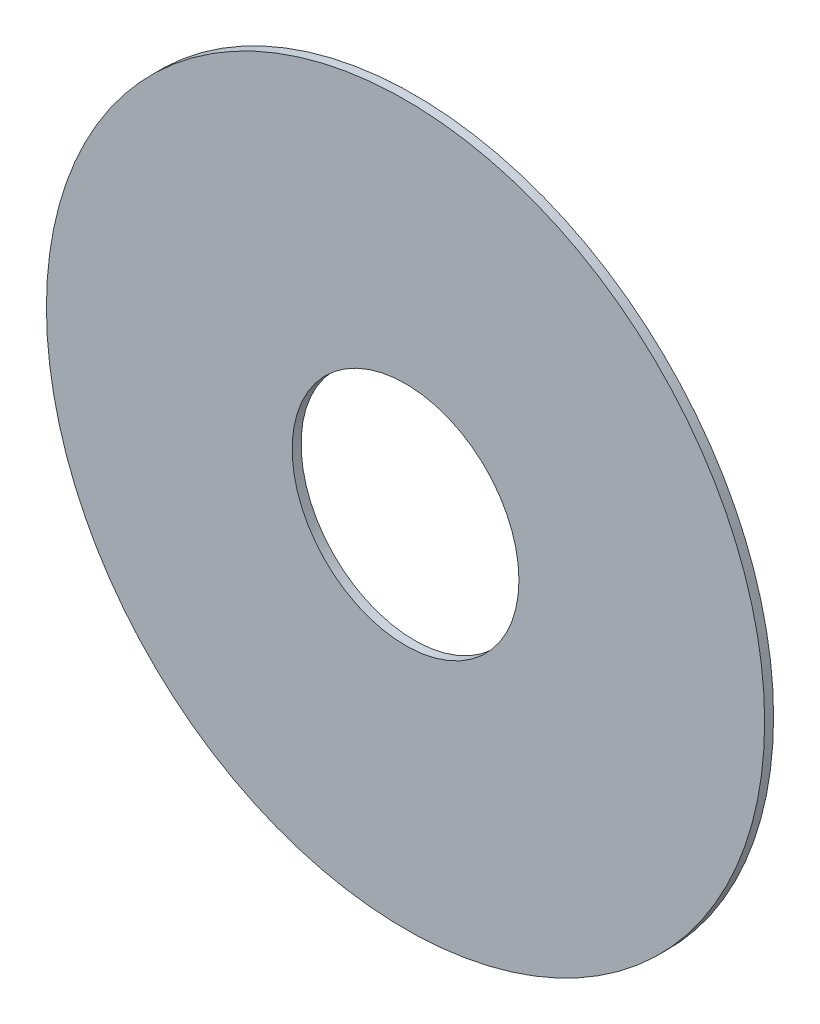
SolidWorks part; units mm, degrees
ref_plane "Front Plane" through (0, 0, 0) normal (0, 0, 1) x (1, 0, 0)
ref_plane "Top Plane" through (0, 0, 0) normal (0, 1, 0) x (1, 0, 0)
ref_plane "Right Plane" through (0, 0, 0) normal (1, 0, 0) x (0, 0, -1)
sketch "Sketch1" plane through (0, 0, 0) normal (0, 0, 1) x (1, 0, 0)
  circle A0 centre (0, 0) radius 12.065
  circle A1 centre (0, 0) radius 3.81
  dimension "D1" = 7.62
  dimension "D2" = 24.13
extrude "Boss-Extrude1" add sketch "Sketch1" along normal blind 0.3
